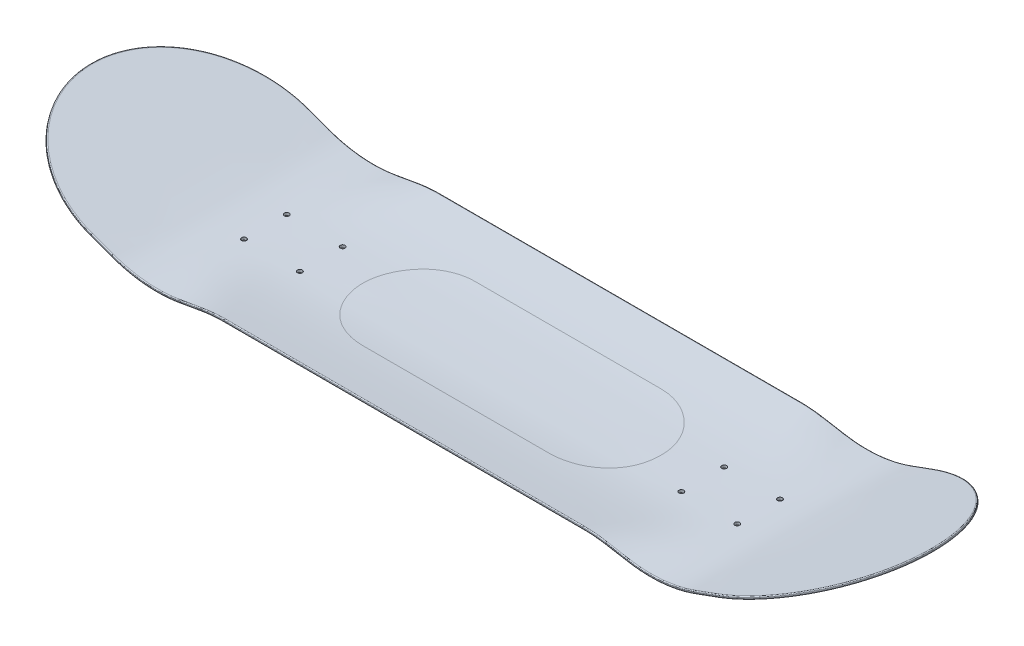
SolidWorks part; units mm, degrees
ref_plane "Front Plane" through (0, 0, 0) normal (0, 0, 1) x (1, 0, 0)
ref_plane "Top Plane" through (0, 0, 0) normal (0, 1, 0) x (1, 0, 0)
ref_plane "Right Plane" through (0, 0, 0) normal (1, 0, 0) x (0, 0, -1)
ref_plane "Plane1" through (0, 0, 104.775) normal (0, 0, 1) x (1, 0, 0)
ref_plane "Plane2" through (0, 0, -104.775) normal (0, 0, 1) x (1, 0, 0)
ref_plane "Plane3" through (0, 0, 25.4) normal (0, 0, 1) x (1, 0, 0)
ref_plane "Plane4" through (0, 0, -25.4) normal (0, 0, 1) x (1, 0, 0)
sketch "Sketch1" plane through (0, 0, 104.775) normal (0, 0, 1) x (1, 0, 0)
  line L0 (-216.0717, -5.6287) -> (-195.0923, -1.9294)
  line L1 (-173.0389, 0) -> (173.0389, 0)
  line L3 (-281.5616, 0.101) -> (-406.4, 45.5384)
  line L4 (281.5616, 0.101) -> (406.4, 45.5384)
  line L5 (195.0923, -1.9294) -> (216.0717, -5.6287)
  line L6 (0, 0) -> (0, -50000) construction
  line L7 (13.6066, -7.5581) -> (-49986.3934, -7.5581) construction
  arc A0 (-281.5616, 0.101) -> (-216.0717, -5.6287) centre (-238.125, 119.4419) ccw
  arc A1 (-195.0923, -1.9294) -> (-173.0389, 0) centre (-173.0389, -127) cw
  arc A2 (173.0389, 0) -> (195.0923, -1.9294) centre (173.0389, -127) cw
  arc A3 (216.0717, -5.6287) -> (281.5616, 0.101) centre (238.125, 119.4419) ccw
  point P4 (0, 0)
  point P13 (-249.5842, -11.5378)
  point P17 (-184.15, 0)
  point P20 (184.15, 0)
  point P23 (-238.125, -7.5581)
sketch "Sketch2" plane through (0, 0, 0) normal (0, 0, 1) x (1, 0, 0)
  line L0 (0, -7.5581) -> (-50000, -7.5581) construction
  line L2 (-238.125, -7.5581) -> (238.125, -7.5581)
  line L12 (-281.5616, 0.101) -> (-406.4, 45.5384) construction
  line L16 (281.5616, 0.101) -> (406.4, 45.5384) construction
  line L19 (-281.5616, 0.101) -> (-406.4, 45.5384)
  line L23 (281.5616, 0.101) -> (406.4, 45.5384)
  arc A0 (-281.5616, 0.101) -> (-216.0717, -5.6287) centre (-238.125, 119.4419) ccw construction
  arc A1 (281.5616, 0.101) -> (238.125, -7.5581) centre (238.125, 119.4419) cw
  arc A2 (-238.125, -7.5581) -> (-281.5616, 0.101) centre (-238.125, 119.4419) cw
  point P11 (260.5185, -7.5581)
  point P14 (-260.5185, -7.5581)
sketch "Sketch3" plane through (0, 0, 0) normal (0, 1, 0) x (1, 0, 0)
  line L0 (-301.625, 0) -> (301.625, 0) construction
  line L1 (-301.625, 104.775) -> (301.625, 104.775)
  line L2 (-301.625, -104.775) -> (301.625, -104.775)
  arc A0 (-301.625, 104.775) -> (-301.625, -104.775) centre (-301.625, 0) ccw
  arc A1 (301.625, -104.775) -> (301.625, 104.775) centre (301.625, 0) ccw
  point P2 (0, 0)
  point P8 (-406.4, 0)
  point P9 (406.4, 0)
sketch "Sketch4" plane through (0, 0, -104.775) normal (0, 0, 1) x (1, 0, 0)
  line L0 (-281.5616, 0.101) -> (-406.4, 45.5384) construction
  line L1 (-216.0717, -5.6287) -> (-195.0923, -1.9294) construction
  line L2 (-173.0389, 0) -> (173.0389, 0) construction
  line L3 (195.0923, -1.9294) -> (216.0717, -5.6287) construction
  line L4 (281.5616, 0.101) -> (406.4, 45.5384) construction
  line L5 (-281.5616, 0.101) -> (-406.4, 45.5384)
  line L6 (-216.0717, -5.6287) -> (-195.0923, -1.9294)
  line L7 (-173.0389, 0) -> (173.0389, 0)
  line L8 (195.0923, -1.9294) -> (216.0717, -5.6287)
  line L9 (281.5616, 0.101) -> (406.4, 45.5384)
  arc A0 (-281.5616, 0.101) -> (-216.0717, -5.6287) centre (-238.125, 119.4419) ccw construction
  arc A1 (-173.0389, 0) -> (-195.0923, -1.9294) centre (-173.0389, -127) ccw construction
  arc A2 (195.0923, -1.9294) -> (173.0389, 0) centre (173.0389, -127) ccw construction
  arc A3 (216.0717, -5.6287) -> (281.5616, 0.101) centre (238.125, 119.4419) ccw construction
  arc A4 (-281.5616, 0.101) -> (-216.0717, -5.6287) centre (-238.125, 119.4419) ccw
  arc A5 (-173.0389, 0) -> (-195.0923, -1.9294) centre (-173.0389, -127) ccw
  arc A6 (195.0923, -1.9294) -> (173.0389, 0) centre (173.0389, -127) ccw
  arc A7 (216.0717, -5.6287) -> (281.5616, 0.101) centre (238.125, 119.4419) ccw
sketch "Sketch5" plane through (0, 0, 25.4) normal (0, 0, 1) x (1, 0, 0)
  line L3 (281.5616, 0.101) -> (406.4, 45.5384) construction
  line L4 (-238.125, -7.5581) -> (238.125, -7.5581) construction
  line L5 (-281.5616, 0.101) -> (-406.4, 45.5384) construction
  line L6 (281.5616, 0.101) -> (406.4, 45.5384)
  line L7 (-238.125, -7.5581) -> (238.125, -7.5581)
  line L8 (-281.5616, 0.101) -> (-406.4, 45.5384)
  arc A2 (238.125, -7.5581) -> (281.5616, 0.101) centre (238.125, 119.4419) ccw construction
  arc A3 (-281.5616, 0.101) -> (-238.125, -7.5581) centre (-238.125, 119.4419) ccw construction
  arc A4 (238.125, -7.5581) -> (281.5616, 0.101) centre (238.125, 119.4419) ccw
  arc A5 (-281.5616, 0.101) -> (-238.125, -7.5581) centre (-238.125, 119.4419) ccw
sketch "Sketch6" plane through (0, 0, -25.4) normal (0, 0, 1) x (1, 0, 0)
  line L3 (281.5616, 0.101) -> (406.4, 45.5384) construction
  line L4 (-238.125, -7.5581) -> (238.125, -7.5581) construction
  line L5 (-281.5616, 0.101) -> (-406.4, 45.5384) construction
  line L6 (281.5616, 0.101) -> (406.4, 45.5384)
  line L7 (-238.125, -7.5581) -> (238.125, -7.5581)
  line L8 (-281.5616, 0.101) -> (-406.4, 45.5384)
  arc A2 (238.125, -7.5581) -> (281.5616, 0.101) centre (238.125, 119.4419) ccw construction
  arc A3 (-281.5616, 0.101) -> (-238.125, -7.5581) centre (-238.125, 119.4419) ccw construction
  arc A4 (238.125, -7.5581) -> (281.5616, 0.101) centre (238.125, 119.4419) ccw
  arc A5 (-281.5616, 0.101) -> (-238.125, -7.5581) centre (-238.125, 119.4419) ccw
other "Boundary-Surface1"
surface "Surface-Trim1"
thicken "Thicken1" surfaces to thicken 110 thickness 1.27 parameters "D1"=1.27
sketch "Sketch8" plane through (0, 0, 0) normal (0, -1, 0) x (-1, 0, 0)
  line L0 (0, -9.525) -> (0, 0) construction
  line L1 (-2.7496, -7.9375) -> (-19.2474, -36.5125)
  line L2 (-16.4978, -41.275) -> (16.4978, -41.275)
  line L3 (19.2474, -36.5125) -> (2.7496, -7.9375)
  line L4 (-8.2489, -4.7625) -> (0, 0) construction
  line L5 (-8.2489, -1.5875) -> (-41.2445, -1.5875)
  line L6 (-43.9941, -6.35) -> (-27.4963, -34.925)
  line L7 (-21.997, -34.925) -> (-5.4993, -6.35)
  line L8 (-8.2489, 4.7625) -> (0, 0) construction
  line L9 (-5.4993, 6.35) -> (-21.997, 34.925)
  line L10 (-27.4963, 34.925) -> (-43.9941, 6.35)
  line L11 (-41.2445, 1.5875) -> (-8.2489, 1.5875)
  line L12 (0, 9.525) -> (0, 0) construction
  line L13 (2.7496, 7.9375) -> (19.2474, 36.5125)
  line L14 (16.4978, 41.275) -> (-16.4978, 41.275)
  line L15 (-19.2474, 36.5125) -> (-2.7496, 7.9375)
  line L16 (8.2489, 4.7625) -> (0, 0) construction
  line L17 (8.2489, 1.5875) -> (41.2445, 1.5875)
  line L18 (43.9941, 6.35) -> (27.4963, 34.925)
  line L19 (21.997, 34.925) -> (5.4993, 6.35)
  line L20 (8.2489, -4.7625) -> (0, 0) construction
  line L21 (5.4993, -6.35) -> (21.997, -34.925)
  line L22 (27.4963, -34.925) -> (43.9941, -6.35)
  line L23 (41.2445, -1.5875) -> (8.2489, -1.5875)
  line L108 (-54.9926, 6.35) -> (-71.4904, 34.925)
  line L193 (-76.9897, 34.925) -> (-93.4874, 6.35)
  line L281 (-90.7378, 1.5875) -> (-57.7422, 1.5875)
  line L282 (-46.7437, 7.9375) -> (-30.2459, 36.5125)
  line L283 (-32.9956, 41.275) -> (-65.9911, 41.275)
  line L284 (-68.7408, 36.5125) -> (-52.243, 7.9375)
  line L285 (-57.7422, -1.5875) -> (-90.7378, -1.5875)
  line L286 (-93.4874, -6.35) -> (-76.9897, -34.925)
  line L287 (-71.4904, -34.925) -> (-54.9926, -6.35)
  line L288 (-52.243, -7.9375) -> (-68.7408, -36.5125)
  line L289 (-65.9911, -41.275) -> (-32.9956, -41.275)
  line L290 (-30.2459, -36.5125) -> (-46.7437, -7.9375)
  line L291 (-104.486, 6.35) -> (-120.9837, 34.925)
  line L292 (-126.483, 34.925) -> (-142.9808, 6.35)
  line L293 (-140.2312, 1.5875) -> (-107.2356, 1.5875)
  line L294 (-96.2371, 7.9375) -> (-79.7393, 36.5125)
  line L295 (-82.4889, 41.275) -> (-115.4845, 41.275)
  line L296 (-118.2341, 36.5125) -> (-101.7363, 7.9375)
  line L297 (-107.2356, -1.5875) -> (-140.2312, -1.5875)
  line L298 (-142.9808, -6.35) -> (-126.483, -34.925)
  line L299 (-120.9837, -34.925) -> (-104.486, -6.35)
  line L300 (-101.7363, -7.9375) -> (-118.2341, -36.5125)
  line L301 (-115.4845, -41.275) -> (-82.4889, -41.275)
  line L302 (-79.7393, -36.5125) -> (-96.2371, -7.9375)
  line L303 (-153.9793, 6.35) -> (-170.4771, 34.925) construction
  line L304 (-175.9764, 34.925) -> (-192.4741, 6.35) construction
  line L305 (-189.7245, 1.5875) -> (-156.7289, 1.5875) construction
  line L306 (-145.7304, 7.9375) -> (-129.2326, 36.5125)
  line L307 (-131.9823, 41.275) -> (-164.9778, 41.275)
  line L308 (-167.7275, 36.5125) -> (-151.2297, 7.9375)
  line L309 (-156.7289, -1.5875) -> (-189.7245, -1.5875) construction
  line L310 (-192.4741, -6.35) -> (-175.9764, -34.925) construction
  line L311 (-170.4771, -34.925) -> (-153.9793, -6.35) construction
  line L312 (-151.2297, -7.9375) -> (-167.7275, -36.5125)
  line L313 (-164.9778, -41.275) -> (-131.9823, -41.275)
  line L314 (-129.2326, -36.5125) -> (-145.7304, -7.9375)
  line L315 (-203.4727, 6.35) -> (-219.9705, 34.925) construction
  line L316 (-225.4697, 34.925) -> (-241.9675, 6.35) construction
  line L317 (-239.2179, 1.5875) -> (-206.2223, 1.5875) construction
  line L318 (-195.2238, 7.9375) -> (-178.726, 36.5125) construction
  line L319 (-181.4756, 41.275) -> (-214.4712, 41.275) construction
  line L320 (-217.2208, 36.5125) -> (-200.723, 7.9375) construction
  line L321 (-206.2223, -1.5875) -> (-239.2179, -1.5875) construction
  line L322 (-241.9675, -6.35) -> (-225.4697, -34.925) construction
  line L323 (-219.9705, -34.925) -> (-203.4727, -6.35) construction
  line L324 (-200.723, -7.9375) -> (-217.2208, -36.5125) construction
  line L325 (-214.4712, -41.275) -> (-181.4756, -41.275) construction
  line L326 (-178.726, -36.5125) -> (-195.2238, -7.9375) construction
  line L327 (-252.966, 6.35) -> (-269.4638, 34.925)
  line L328 (-274.9631, 34.925) -> (-291.4608, 6.35)
  line L329 (-288.7112, 1.5875) -> (-255.7157, 1.5875)
  line L330 (-244.7171, 7.9375) -> (-228.2193, 36.5125) construction
  line L331 (-230.969, 41.275) -> (-263.9645, 41.275) construction
  line L332 (-266.7142, 36.5125) -> (-250.2164, 7.9375) construction
  line L333 (-255.7157, -1.5875) -> (-288.7112, -1.5875)
  line L334 (-291.4608, -6.35) -> (-274.9631, -34.925)
  line L335 (-269.4638, -34.925) -> (-252.966, -6.35)
  line L336 (-250.2164, -7.9375) -> (-266.7142, -36.5125) construction
  line L337 (-263.9645, -41.275) -> (-230.969, -41.275) construction
  line L338 (-228.2193, -36.5125) -> (-244.7171, -7.9375) construction
  line L339 (-302.4594, 6.35) -> (-318.9572, 34.925)
  line L340 (-324.4564, 34.925) -> (-340.9542, 6.35)
  line L341 (-338.2046, 1.5875) -> (-305.209, 1.5875)
  line L342 (-294.2105, 7.9375) -> (-277.7127, 36.5125)
  line L343 (-280.4623, 41.275) -> (-313.4579, 41.275)
  line L344 (-316.2075, 36.5125) -> (-299.7097, 7.9375)
  line L345 (-305.209, -1.5875) -> (-338.2046, -1.5875)
  line L346 (-340.9542, -6.35) -> (-324.4564, -34.925)
  line L347 (-318.9572, -34.925) -> (-302.4594, -6.35)
  line L348 (-299.7097, -7.9375) -> (-316.2075, -36.5125)
  line L349 (-313.4579, -41.275) -> (-280.4623, -41.275)
  line L350 (-277.7127, -36.5125) -> (-294.2105, -7.9375)
  line L351 (-351.9527, 6.35) -> (-368.4505, 34.925)
  line L352 (-373.9498, 34.925) -> (-390.4476, 6.35)
  line L353 (-387.6979, 1.5875) -> (-354.7024, 1.5875)
  line L354 (-343.7038, 7.9375) -> (-327.206, 36.5125)
  line L355 (-329.9557, 41.275) -> (-362.9512, 41.275)
  line L356 (-365.7009, 36.5125) -> (-349.2031, 7.9375)
  line L357 (-354.7024, -1.5875) -> (-387.6979, -1.5875)
  line L358 (-390.4476, -6.35) -> (-373.9498, -34.925)
  line L359 (-368.4505, -34.925) -> (-351.9527, -6.35)
  line L360 (-349.2031, -7.9375) -> (-365.7009, -36.5125)
  line L361 (-362.9512, -41.275) -> (-329.9557, -41.275)
  line L362 (-327.206, -36.5125) -> (-343.7038, -7.9375)
  line L363 (329.9557, 44.45) -> (362.9512, 44.45)
  line L364 (46.7437, -7.9375) -> (30.2459, -36.5125)
  line L365 (32.9956, -41.275) -> (65.9911, -41.275)
  line L366 (68.7408, -36.5125) -> (52.243, -7.9375)
  line L367 (54.9926, -6.35) -> (71.4904, -34.925)
  line L368 (76.9897, -34.925) -> (93.4874, -6.35)
  line L369 (90.7378, -1.5875) -> (57.7422, -1.5875)
  line L370 (57.7422, 1.5875) -> (90.7378, 1.5875)
  line L371 (93.4874, 6.35) -> (76.9897, 34.925)
  line L372 (71.4904, 34.925) -> (54.9926, 6.35)
  line L373 (52.243, 7.9375) -> (68.7408, 36.5125)
  line L374 (65.9911, 41.275) -> (32.9956, 41.275)
  line L375 (30.2459, 36.5125) -> (46.7437, 7.9375)
  line L376 (96.2371, -7.9375) -> (79.7393, -36.5125)
  line L377 (82.4889, -41.275) -> (115.4845, -41.275)
  line L378 (118.2341, -36.5125) -> (101.7363, -7.9375)
  line L379 (104.486, -6.35) -> (120.9837, -34.925)
  line L380 (126.483, -34.925) -> (142.9808, -6.35)
  line L381 (140.2312, -1.5875) -> (107.2356, -1.5875)
  line L382 (107.2356, 1.5875) -> (140.2312, 1.5875)
  line L383 (142.9808, 6.35) -> (126.483, 34.925)
  line L384 (120.9837, 34.925) -> (104.486, 6.35)
  line L385 (101.7363, 7.9375) -> (118.2341, 36.5125)
  line L386 (115.4845, 41.275) -> (82.4889, 41.275)
  line L387 (79.7393, 36.5125) -> (96.2371, 7.9375)
  line L388 (145.7304, -7.9375) -> (129.2326, -36.5125)
  line L389 (131.9823, -41.275) -> (164.9778, -41.275)
  line L390 (167.7275, -36.5125) -> (151.2297, -7.9375)
  line L391 (153.9793, -6.35) -> (170.4771, -34.925) construction
  line L392 (175.9764, -34.925) -> (192.4741, -6.35) construction
  line L393 (189.7245, -1.5875) -> (156.7289, -1.5875) construction
  line L394 (156.7289, 1.5875) -> (189.7245, 1.5875) construction
  line L395 (192.4741, 6.35) -> (175.9764, 34.925) construction
  line L396 (170.4771, 34.925) -> (153.9793, 6.35) construction
  line L397 (151.2297, 7.9375) -> (167.7275, 36.5125)
  line L398 (164.9778, 41.275) -> (131.9823, 41.275)
  line L399 (129.2326, 36.5125) -> (145.7304, 7.9375)
  line L400 (195.2238, -7.9375) -> (178.726, -36.5125) construction
  line L401 (181.4756, -41.275) -> (214.4712, -41.275) construction
  line L402 (217.2208, -36.5125) -> (200.723, -7.9375) construction
  line L403 (203.4727, -6.35) -> (219.9705, -34.925) construction
  line L404 (225.4697, -34.925) -> (241.9675, -6.35) construction
  line L405 (239.2179, -1.5875) -> (206.2223, -1.5875) construction
  line L406 (206.2223, 1.5875) -> (239.2179, 1.5875) construction
  line L407 (241.9675, 6.35) -> (225.4697, 34.925) construction
  line L408 (219.9705, 34.925) -> (203.4727, 6.35) construction
  line L409 (200.723, 7.9375) -> (217.2208, 36.5125) construction
  line L410 (214.4712, 41.275) -> (181.4756, 41.275) construction
  line L411 (178.726, 36.5125) -> (195.2238, 7.9375) construction
  line L412 (244.7171, -7.9375) -> (228.2193, -36.5125) construction
  line L413 (230.969, -41.275) -> (263.9645, -41.275) construction
  line L414 (266.7142, -36.5125) -> (250.2164, -7.9375) construction
  line L415 (252.966, -6.35) -> (269.4638, -34.925)
  line L416 (274.9631, -34.925) -> (291.4608, -6.35)
  line L417 (288.7112, -1.5875) -> (255.7157, -1.5875)
  line L418 (255.7157, 1.5875) -> (288.7112, 1.5875)
  line L419 (291.4608, 6.35) -> (274.9631, 34.925)
  line L420 (269.4638, 34.925) -> (252.966, 6.35)
  line L421 (250.2164, 7.9375) -> (266.7142, 36.5125) construction
  line L422 (263.9645, 41.275) -> (230.969, 41.275) construction
  line L423 (228.2193, 36.5125) -> (244.7171, 7.9375) construction
  line L424 (294.2105, -7.9375) -> (277.7127, -36.5125)
  line L425 (280.4623, -41.275) -> (313.4579, -41.275)
  line L426 (316.2075, -36.5125) -> (299.7097, -7.9375)
  line L427 (302.4594, -6.35) -> (318.9572, -34.925)
  line L428 (324.4564, -34.925) -> (340.9542, -6.35)
  line L429 (338.2046, -1.5875) -> (305.209, -1.5875)
  line L430 (305.209, 1.5875) -> (338.2046, 1.5875)
  line L431 (340.9542, 6.35) -> (324.4564, 34.925)
  line L432 (318.9572, 34.925) -> (302.4594, 6.35)
  line L433 (299.7097, 7.9375) -> (316.2075, 36.5125)
  line L434 (313.4579, 41.275) -> (280.4623, 41.275)
  line L435 (277.7127, 36.5125) -> (294.2105, 7.9375)
  line L436 (343.7038, -7.9375) -> (327.206, -36.5125)
  line L437 (329.9557, -41.275) -> (362.9512, -41.275)
  line L438 (365.7009, -36.5125) -> (349.2031, -7.9375)
  line L439 (351.9527, -6.35) -> (368.4505, -34.925)
  line L440 (373.9498, -34.925) -> (390.4476, -6.35)
  line L441 (387.6979, -1.5875) -> (354.7024, -1.5875)
  line L442 (354.7024, 1.5875) -> (387.6979, 1.5875)
  line L443 (390.4476, 6.35) -> (373.9498, 34.925)
  line L444 (368.4505, 34.925) -> (351.9527, 6.35)
  line L445 (349.2031, 7.9375) -> (365.7009, 36.5125)
  line L446 (362.9512, 41.275) -> (329.9557, 41.275)
  line L447 (327.206, 36.5125) -> (343.7038, 7.9375)
  line L448 (365.7009, 49.2125) -> (349.2031, 77.7875)
  line L449 (343.7038, 77.7875) -> (327.206, 49.2125)
  line L450 (324.4564, 50.8) -> (340.9542, 79.375)
  line L451 (338.2046, 84.1375) -> (305.209, 84.1375)
  line L452 (302.4594, 79.375) -> (318.9572, 50.8)
  line L453 (280.4623, 44.45) -> (313.4579, 44.45)
  line L454 (316.2075, 49.2125) -> (299.7097, 77.7875)
  line L455 (294.2105, 77.7875) -> (277.7127, 49.2125)
  line L456 (274.9631, 50.8) -> (291.4608, 79.375)
  line L457 (288.7112, 84.1375) -> (255.7157, 84.1375)
  line L458 (252.966, 79.375) -> (269.4638, 50.8)
  line L459 (230.969, 44.45) -> (263.9645, 44.45)
  line L460 (266.7142, 49.2125) -> (250.2164, 77.7875)
  line L461 (244.7171, 77.7875) -> (228.2193, 49.2125)
  line L462 (225.4697, 50.8) -> (241.9675, 79.375)
  line L463 (239.2179, 84.1375) -> (206.2223, 84.1375)
  line L464 (203.4727, 79.375) -> (219.9705, 50.8)
  line L465 (181.4756, 44.45) -> (214.4712, 44.45)
  line L466 (217.2208, 49.2125) -> (200.723, 77.7875)
  line L467 (195.2238, 77.7875) -> (178.726, 49.2125)
  line L468 (175.9764, 50.8) -> (192.4741, 79.375)
  line L469 (189.7245, 84.1375) -> (156.7289, 84.1375)
  line L470 (153.9793, 79.375) -> (170.4771, 50.8)
  line L471 (131.9823, 44.45) -> (164.9778, 44.45)
  line L472 (167.7275, 49.2125) -> (151.2297, 77.7875)
  line L473 (145.7304, 77.7875) -> (129.2326, 49.2125)
  line L474 (126.483, 50.8) -> (142.9808, 79.375)
  line L475 (140.2312, 84.1375) -> (107.2356, 84.1375)
  line L476 (104.486, 79.375) -> (120.9837, 50.8)
  line L477 (82.4889, 44.45) -> (115.4845, 44.45)
  line L478 (118.2341, 49.2125) -> (101.7363, 77.7875)
  line L479 (96.2371, 77.7875) -> (79.7393, 49.2125)
  line L480 (76.9897, 50.8) -> (93.4874, 79.375)
  line L481 (90.7378, 84.1375) -> (57.7422, 84.1375)
  line L482 (54.9926, 79.375) -> (71.4904, 50.8)
  line L483 (32.9956, 44.45) -> (65.9911, 44.45)
  line L484 (68.7408, 49.2125) -> (52.243, 77.7875)
  line L485 (46.7437, 77.7875) -> (30.2459, 49.2125)
  line L486 (27.4963, 50.8) -> (43.9941, 79.375)
  line L487 (41.2445, 84.1375) -> (8.2489, 84.1375)
  line L488 (5.4993, 79.375) -> (21.997, 50.8)
  line L489 (19.2474, 49.2125) -> (2.7496, 77.7875)
  line L490 (-2.7496, 77.7875) -> (-19.2474, 49.2125)
  line L491 (-16.4978, 44.45) -> (16.4978, 44.45)
  line L492 (-21.997, 50.8) -> (-5.4993, 79.375)
  line L493 (-8.2489, 84.1375) -> (-41.2445, 84.1375)
  line L494 (-43.9941, 79.375) -> (-27.4963, 50.8)
  line L495 (-30.2459, 49.2125) -> (-46.7437, 77.7875)
  line L496 (-52.243, 77.7875) -> (-68.7408, 49.2125)
  line L497 (-65.9911, 44.45) -> (-32.9956, 44.45)
  line L498 (-71.4904, 50.8) -> (-54.9926, 79.375)
  line L499 (-57.7422, 84.1375) -> (-90.7378, 84.1375)
  line L500 (-93.4874, 79.375) -> (-76.9897, 50.8)
  line L501 (-79.7393, 49.2125) -> (-96.2371, 77.7875)
  line L502 (-101.7363, 77.7875) -> (-118.2341, 49.2125)
  line L503 (-115.4845, 44.45) -> (-82.4889, 44.45)
  line L504 (-120.9837, 50.8) -> (-104.486, 79.375)
  line L505 (-107.2356, 84.1375) -> (-140.2312, 84.1375)
  line L506 (-142.9808, 79.375) -> (-126.483, 50.8)
  line L507 (-129.2326, 49.2125) -> (-145.7304, 77.7875)
  line L508 (-151.2297, 77.7875) -> (-167.7275, 49.2125)
  line L509 (-164.9778, 44.45) -> (-131.9823, 44.45)
  line L510 (-170.4771, 50.8) -> (-153.9793, 79.375)
  line L511 (-156.7289, 84.1375) -> (-189.7245, 84.1375)
  line L512 (-192.4741, 79.375) -> (-175.9764, 50.8)
  line L513 (-178.726, 49.2125) -> (-195.2238, 77.7875)
  line L514 (-200.723, 77.7875) -> (-217.2208, 49.2125)
  line L515 (-214.4712, 44.45) -> (-181.4756, 44.45)
  line L516 (-219.9705, 50.8) -> (-203.4727, 79.375)
  line L517 (-206.2223, 84.1375) -> (-239.2179, 84.1375)
  line L518 (-241.9675, 79.375) -> (-225.4697, 50.8)
  line L519 (-228.2193, 49.2125) -> (-244.7171, 77.7875)
  line L520 (-250.2164, 77.7875) -> (-266.7142, 49.2125)
  line L521 (-263.9645, 44.45) -> (-230.969, 44.45)
  line L522 (-269.4638, 50.8) -> (-252.966, 79.375)
  line L523 (-255.7157, 84.1375) -> (-288.7112, 84.1375)
  line L524 (-291.4608, 79.375) -> (-274.9631, 50.8)
  line L525 (-277.7127, 49.2125) -> (-294.2105, 77.7875)
  line L526 (-299.7097, 77.7875) -> (-316.2075, 49.2125)
  line L527 (-313.4579, 44.45) -> (-280.4623, 44.45)
  line L528 (-318.9572, 50.8) -> (-302.4594, 79.375)
  line L529 (-305.209, 84.1375) -> (-338.2046, 84.1375)
  line L530 (-340.9542, 79.375) -> (-324.4564, 50.8)
  line L531 (-327.206, 49.2125) -> (-343.7038, 77.7875)
  line L532 (-349.2031, 77.7875) -> (-365.7009, 49.2125)
  line L533 (-362.9512, 44.45) -> (-329.9557, 44.45)
  line L534 (277.7127, -49.2125) -> (294.2105, -77.7875)
  line L535 (299.7097, -77.7875) -> (316.2075, -49.2125)
  line L536 (313.4579, -44.45) -> (280.4623, -44.45)
  line L537 (269.4638, -50.8) -> (252.966, -79.375)
  line L538 (255.7157, -84.1375) -> (288.7112, -84.1375)
  line L539 (291.4608, -79.375) -> (274.9631, -50.8)
  line L540 (228.2193, -49.2125) -> (244.7171, -77.7875)
  line L541 (250.2164, -77.7875) -> (266.7142, -49.2125)
  line L542 (263.9645, -44.45) -> (230.969, -44.45)
  line L543 (219.9705, -50.8) -> (203.4727, -79.375)
  line L544 (206.2223, -84.1375) -> (239.2179, -84.1375)
  line L545 (241.9675, -79.375) -> (225.4697, -50.8)
  line L546 (178.726, -49.2125) -> (195.2238, -77.7875)
  line L547 (200.723, -77.7875) -> (217.2208, -49.2125)
  line L548 (214.4712, -44.45) -> (181.4756, -44.45)
  line L549 (170.4771, -50.8) -> (153.9793, -79.375)
  line L550 (156.7289, -84.1375) -> (189.7245, -84.1375)
  line L551 (192.4741, -79.375) -> (175.9764, -50.8)
  line L552 (129.2326, -49.2125) -> (145.7304, -77.7875)
  line L553 (151.2297, -77.7875) -> (167.7275, -49.2125)
  line L554 (164.9778, -44.45) -> (131.9823, -44.45)
  line L555 (120.9837, -50.8) -> (104.486, -79.375)
  line L556 (107.2356, -84.1375) -> (140.2312, -84.1375)
  line L557 (142.9808, -79.375) -> (126.483, -50.8)
  line L558 (79.7393, -49.2125) -> (96.2371, -77.7875)
  line L559 (101.7363, -77.7875) -> (118.2341, -49.2125)
  line L560 (115.4845, -44.45) -> (82.4889, -44.45)
  line L561 (71.4904, -50.8) -> (54.9926, -79.375)
  line L562 (57.7422, -84.1375) -> (90.7378, -84.1375)
  line L563 (93.4874, -79.375) -> (76.9897, -50.8)
  line L564 (30.2459, -49.2125) -> (46.7437, -77.7875)
  line L565 (52.243, -77.7875) -> (68.7408, -49.2125)
  line L566 (65.9911, -44.45) -> (32.9956, -44.45)
  line L567 (21.997, -50.8) -> (5.4993, -79.375)
  line L568 (8.2489, -84.1375) -> (41.2445, -84.1375)
  line L569 (43.9941, -79.375) -> (27.4963, -50.8)
  line L570 (-19.2474, -49.2125) -> (-2.7496, -77.7875)
  line L571 (2.7496, -77.7875) -> (19.2474, -49.2125)
  line L572 (16.4978, -44.45) -> (-16.4978, -44.45)
  line L573 (-27.4963, -50.8) -> (-43.9941, -79.375)
  line L574 (-41.2445, -84.1375) -> (-8.2489, -84.1375)
  line L575 (-5.4993, -79.375) -> (-21.997, -50.8)
  line L576 (-32.9956, -44.45) -> (-65.9911, -44.45)
  line L577 (-68.7408, -49.2125) -> (-52.243, -77.7875)
  line L578 (-46.7437, -77.7875) -> (-30.2459, -49.2125)
  line L579 (-76.9897, -50.8) -> (-93.4874, -79.375)
  line L580 (-90.7378, -84.1375) -> (-57.7422, -84.1375)
  line L581 (-54.9926, -79.375) -> (-71.4904, -50.8)
  line L582 (-82.4889, -44.45) -> (-115.4845, -44.45)
  line L583 (-118.2341, -49.2125) -> (-101.7363, -77.7875)
  line L584 (-96.2371, -77.7875) -> (-79.7393, -49.2125)
  line L585 (-126.483, -50.8) -> (-142.9808, -79.375)
  line L586 (-140.2312, -84.1375) -> (-107.2356, -84.1375)
  line L587 (-104.486, -79.375) -> (-120.9837, -50.8)
  line L588 (-131.9823, -44.45) -> (-164.9778, -44.45)
  line L589 (-167.7275, -49.2125) -> (-151.2297, -77.7875)
  line L590 (-145.7304, -77.7875) -> (-129.2326, -49.2125)
  line L591 (-175.9764, -50.8) -> (-192.4741, -79.375)
  line L592 (-189.7245, -84.1375) -> (-156.7289, -84.1375)
  line L593 (-153.9793, -79.375) -> (-170.4771, -50.8)
  line L594 (-181.4756, -44.45) -> (-214.4712, -44.45)
  line L595 (-217.2208, -49.2125) -> (-200.723, -77.7875)
  line L596 (-195.2238, -77.7875) -> (-178.726, -49.2125)
  line L597 (-225.4697, -50.8) -> (-241.9675, -79.375)
  line L598 (-239.2179, -84.1375) -> (-206.2223, -84.1375)
  line L599 (-203.4727, -79.375) -> (-219.9705, -50.8)
  line L600 (-230.969, -44.45) -> (-263.9645, -44.45)
  line L601 (-266.7142, -49.2125) -> (-250.2164, -77.7875)
  line L602 (-244.7171, -77.7875) -> (-228.2193, -49.2125)
  line L603 (-274.9631, -50.8) -> (-291.4608, -79.375)
  line L604 (-288.7112, -84.1375) -> (-255.7157, -84.1375)
  line L605 (-252.966, -79.375) -> (-269.4638, -50.8)
  line L606 (-280.4623, -44.45) -> (-313.4579, -44.45)
  line L607 (-316.2075, -49.2125) -> (-299.7097, -77.7875)
  line L608 (-294.2105, -77.7875) -> (-277.7127, -49.2125)
  line L609 (-324.4564, -50.8) -> (-340.9542, -79.375)
  line L610 (-338.2046, -84.1375) -> (-305.209, -84.1375)
  line L611 (-302.4594, -79.375) -> (-318.9572, -50.8)
  line L612 (-329.9557, -44.45) -> (-362.9512, -44.45)
  line L613 (-365.7009, -49.2125) -> (-349.2031, -77.7875)
  line L614 (-343.7038, -77.7875) -> (-327.206, -49.2125)
  line L615 (318.9572, -50.8) -> (302.4594, -79.375)
  line L616 (305.209, -84.1375) -> (338.2046, -84.1375)
  line L617 (340.9542, -79.375) -> (324.4564, -50.8)
  line L618 (327.206, -49.2125) -> (343.7038, -77.7875)
  line L619 (349.2031, -77.7875) -> (365.7009, -49.2125)
  line L620 (362.9512, -44.45) -> (329.9557, -44.45)
  circle A1 centre (0, -28.575) radius 12.7 construction
  arc A2 (2.7496, -7.9375) -> (-2.7496, -7.9375) centre (0, -9.525) ccw
  arc A3 (-19.2474, -36.5125) -> (-16.4978, -41.275) centre (-16.4978, -38.1) ccw
  arc A4 (16.4978, -41.275) -> (19.2474, -36.5125) centre (16.4978, -38.1) ccw
  arc A5 (-41.2445, -1.5875) -> (-43.9941, -6.35) centre (-41.2445, -4.7625) ccw
  arc A6 (-5.4993, -6.35) -> (-8.2489, -1.5875) centre (-8.2489, -4.7625) ccw
  arc A7 (-27.4963, -34.925) -> (-21.997, -34.925) centre (-24.7467, -33.3375) ccw
  arc A8 (-21.997, 34.925) -> (-27.4963, 34.925) centre (-24.7467, 33.3375) ccw
  arc A9 (-8.2489, 1.5875) -> (-5.4993, 6.35) centre (-8.2489, 4.7625) ccw
  arc A10 (-43.9941, 6.35) -> (-41.2445, 1.5875) centre (-41.2445, 4.7625) ccw
  arc A11 (19.2474, 36.5125) -> (16.4978, 41.275) centre (16.4978, 38.1) ccw
  arc A12 (-2.7496, 7.9375) -> (2.7496, 7.9375) centre (0, 9.525) ccw
  arc A13 (-16.4978, 41.275) -> (-19.2474, 36.5125) centre (-16.4978, 38.1) ccw
  arc A14 (41.2445, 1.5875) -> (43.9941, 6.35) centre (41.2445, 4.7625) ccw
  arc A15 (5.4993, 6.35) -> (8.2489, 1.5875) centre (8.2489, 4.7625) ccw
  arc A16 (27.4963, 34.925) -> (21.997, 34.925) centre (24.7467, 33.3375) ccw
  arc A17 (21.997, -34.925) -> (27.4963, -34.925) centre (24.7467, -33.3375) ccw
  arc A18 (8.2489, -1.5875) -> (5.4993, -6.35) centre (8.2489, -4.7625) ccw
  arc A19 (43.9941, -6.35) -> (41.2445, -1.5875) centre (41.2445, -4.7625) ccw
  arc A275 (-71.4904, 34.925) -> (-76.9897, 34.925) centre (-74.24, 33.3375) ccw
  arc A276 (-93.4874, 6.35) -> (-90.7378, 1.5875) centre (-90.7378, 4.7625) ccw
  arc A277 (-57.7422, 1.5875) -> (-54.9926, 6.35) centre (-57.7422, 4.7625) ccw
  arc A278 (-30.2459, 36.5125) -> (-32.9956, 41.275) centre (-32.9956, 38.1) ccw
  arc A279 (-65.9911, 41.275) -> (-68.7408, 36.5125) centre (-65.9911, 38.1) ccw
  arc A280 (-52.243, 7.9375) -> (-46.7437, 7.9375) centre (-49.4934, 9.525) ccw
  arc A281 (-90.7378, -1.5875) -> (-93.4874, -6.35) centre (-90.7378, -4.7625) ccw
  arc A282 (-76.9897, -34.925) -> (-71.4904, -34.925) centre (-74.24, -33.3375) ccw
  arc A283 (-54.9926, -6.35) -> (-57.7422, -1.5875) centre (-57.7422, -4.7625) ccw
  arc A284 (-68.7408, -36.5125) -> (-65.9911, -41.275) centre (-65.9911, -38.1) ccw
  arc A285 (-46.7437, -7.9375) -> (-52.243, -7.9375) centre (-49.4934, -9.525) ccw
  arc A286 (-32.9956, -41.275) -> (-30.2459, -36.5125) centre (-32.9956, -38.1) ccw
  arc A287 (-120.9837, 34.925) -> (-126.483, 34.925) centre (-123.7334, 33.3375) ccw
  arc A288 (-142.9808, 6.35) -> (-140.2312, 1.5875) centre (-140.2312, 4.7625) ccw
  arc A289 (-107.2356, 1.5875) -> (-104.486, 6.35) centre (-107.2356, 4.7625) ccw
  arc A290 (-79.7393, 36.5125) -> (-82.4889, 41.275) centre (-82.4889, 38.1) ccw
  arc A291 (-115.4845, 41.275) -> (-118.2341, 36.5125) centre (-115.4845, 38.1) ccw
  arc A292 (-101.7363, 7.9375) -> (-96.2371, 7.9375) centre (-98.9867, 9.525) ccw
  arc A293 (-140.2312, -1.5875) -> (-142.9808, -6.35) centre (-140.2312, -4.7625) ccw
  arc A294 (-126.483, -34.925) -> (-120.9837, -34.925) centre (-123.7334, -33.3375) ccw
  arc A295 (-104.486, -6.35) -> (-107.2356, -1.5875) centre (-107.2356, -4.7625) ccw
  arc A296 (-118.2341, -36.5125) -> (-115.4845, -41.275) centre (-115.4845, -38.1) ccw
  arc A297 (-96.2371, -7.9375) -> (-101.7363, -7.9375) centre (-98.9867, -9.525) ccw
  arc A298 (-82.4889, -41.275) -> (-79.7393, -36.5125) centre (-82.4889, -38.1) ccw
  arc A299 (-170.4771, 34.925) -> (-175.9764, 34.925) centre (-173.2267, 33.3375) ccw construction
  arc A300 (-192.4741, 6.35) -> (-189.7245, 1.5875) centre (-189.7245, 4.7625) ccw construction
  arc A301 (-156.7289, 1.5875) -> (-153.9793, 6.35) centre (-156.7289, 4.7625) ccw construction
  arc A302 (-129.2326, 36.5125) -> (-131.9823, 41.275) centre (-131.9823, 38.1) ccw
  arc A303 (-164.9778, 41.275) -> (-167.7275, 36.5125) centre (-164.9778, 38.1) ccw
  arc A304 (-151.2297, 7.9375) -> (-145.7304, 7.9375) centre (-148.4801, 9.525) ccw
  arc A305 (-189.7245, -1.5875) -> (-192.4741, -6.35) centre (-189.7245, -4.7625) ccw construction
  arc A306 (-175.9764, -34.925) -> (-170.4771, -34.925) centre (-173.2267, -33.3375) ccw construction
  arc A307 (-153.9793, -6.35) -> (-156.7289, -1.5875) centre (-156.7289, -4.7625) ccw construction
  arc A308 (-167.7275, -36.5125) -> (-164.9778, -41.275) centre (-164.9778, -38.1) ccw
  arc A309 (-145.7304, -7.9375) -> (-151.2297, -7.9375) centre (-148.4801, -9.525) ccw
  arc A310 (-131.9823, -41.275) -> (-129.2326, -36.5125) centre (-131.9823, -38.1) ccw
  arc A311 (-219.9705, 34.925) -> (-225.4697, 34.925) centre (-222.7201, 33.3375) ccw construction
  arc A312 (-241.9675, 6.35) -> (-239.2179, 1.5875) centre (-239.2179, 4.7625) ccw construction
  arc A313 (-206.2223, 1.5875) -> (-203.4727, 6.35) centre (-206.2223, 4.7625) ccw construction
  arc A314 (-178.726, 36.5125) -> (-181.4756, 41.275) centre (-181.4756, 38.1) ccw construction
  arc A315 (-214.4712, 41.275) -> (-217.2208, 36.5125) centre (-214.4712, 38.1) ccw construction
  arc A316 (-200.723, 7.9375) -> (-195.2238, 7.9375) centre (-197.9734, 9.525) ccw construction
  arc A317 (-239.2179, -1.5875) -> (-241.9675, -6.35) centre (-239.2179, -4.7625) ccw construction
  arc A318 (-225.4697, -34.925) -> (-219.9705, -34.925) centre (-222.7201, -33.3375) ccw construction
  arc A319 (-203.4727, -6.35) -> (-206.2223, -1.5875) centre (-206.2223, -4.7625) ccw construction
  arc A320 (-217.2208, -36.5125) -> (-214.4712, -41.275) centre (-214.4712, -38.1) ccw construction
  arc A321 (-195.2238, -7.9375) -> (-200.723, -7.9375) centre (-197.9734, -9.525) ccw construction
  arc A322 (-181.4756, -41.275) -> (-178.726, -36.5125) centre (-181.4756, -38.1) ccw construction
  arc A323 (-269.4638, 34.925) -> (-274.9631, 34.925) centre (-272.2134, 33.3375) ccw
  arc A324 (-291.4608, 6.35) -> (-288.7112, 1.5875) centre (-288.7112, 4.7625) ccw
  arc A325 (-255.7157, 1.5875) -> (-252.966, 6.35) centre (-255.7157, 4.7625) ccw
  arc A326 (-228.2193, 36.5125) -> (-230.969, 41.275) centre (-230.969, 38.1) ccw construction
  arc A327 (-263.9645, 41.275) -> (-266.7142, 36.5125) centre (-263.9645, 38.1) ccw construction
  arc A328 (-250.2164, 7.9375) -> (-244.7171, 7.9375) centre (-247.4668, 9.525) ccw construction
  arc A329 (-288.7112, -1.5875) -> (-291.4608, -6.35) centre (-288.7112, -4.7625) ccw
  arc A330 (-274.9631, -34.925) -> (-269.4638, -34.925) centre (-272.2134, -33.3375) ccw
  arc A331 (-252.966, -6.35) -> (-255.7157, -1.5875) centre (-255.7157, -4.7625) ccw
  arc A332 (-266.7142, -36.5125) -> (-263.9645, -41.275) centre (-263.9645, -38.1) ccw construction
  arc A333 (-244.7171, -7.9375) -> (-250.2164, -7.9375) centre (-247.4668, -9.525) ccw construction
  arc A334 (-230.969, -41.275) -> (-228.2193, -36.5125) centre (-230.969, -38.1) ccw construction
  arc A335 (-318.9572, 34.925) -> (-324.4564, 34.925) centre (-321.7068, 33.3375) ccw
  arc A336 (-340.9542, 6.35) -> (-338.2046, 1.5875) centre (-338.2046, 4.7625) ccw
  arc A337 (-305.209, 1.5875) -> (-302.4594, 6.35) centre (-305.209, 4.7625) ccw
  arc A338 (-277.7127, 36.5125) -> (-280.4623, 41.275) centre (-280.4623, 38.1) ccw
  arc A339 (-313.4579, 41.275) -> (-316.2075, 36.5125) centre (-313.4579, 38.1) ccw
  arc A340 (-299.7097, 7.9375) -> (-294.2105, 7.9375) centre (-296.9601, 9.525) ccw
  arc A341 (-338.2046, -1.5875) -> (-340.9542, -6.35) centre (-338.2046, -4.7625) ccw
  arc A342 (-324.4564, -34.925) -> (-318.9572, -34.925) centre (-321.7068, -33.3375) ccw
  arc A343 (-302.4594, -6.35) -> (-305.209, -1.5875) centre (-305.209, -4.7625) ccw
  arc A344 (-316.2075, -36.5125) -> (-313.4579, -41.275) centre (-313.4579, -38.1) ccw
  arc A345 (-294.2105, -7.9375) -> (-299.7097, -7.9375) centre (-296.9601, -9.525) ccw
  arc A346 (-280.4623, -41.275) -> (-277.7127, -36.5125) centre (-280.4623, -38.1) ccw
  arc A347 (-368.4505, 34.925) -> (-373.9498, 34.925) centre (-371.2001, 33.3375) ccw
  arc A348 (-390.4476, 6.35) -> (-387.6979, 1.5875) centre (-387.6979, 4.7625) ccw
  arc A349 (-354.7024, 1.5875) -> (-351.9527, 6.35) centre (-354.7024, 4.7625) ccw
  arc A350 (-327.206, 36.5125) -> (-329.9557, 41.275) centre (-329.9557, 38.1) ccw
  arc A351 (-362.9512, 41.275) -> (-365.7009, 36.5125) centre (-362.9512, 38.1) ccw
  arc A352 (-349.2031, 7.9375) -> (-343.7038, 7.9375) centre (-346.4535, 9.525) ccw
  arc A353 (-387.6979, -1.5875) -> (-390.4476, -6.35) centre (-387.6979, -4.7625) ccw
  arc A354 (-373.9498, -34.925) -> (-368.4505, -34.925) centre (-371.2001, -33.3375) ccw
  arc A355 (-351.9527, -6.35) -> (-354.7024, -1.5875) centre (-354.7024, -4.7625) ccw
  arc A356 (-365.7009, -36.5125) -> (-362.9512, -41.275) centre (-362.9512, -38.1) ccw
  arc A357 (-343.7038, -7.9375) -> (-349.2031, -7.9375) centre (-346.4535, -9.525) ccw
  arc A358 (-329.9557, -41.275) -> (-327.206, -36.5125) centre (-329.9557, -38.1) ccw
  arc A359 (30.2459, -36.5125) -> (32.9956, -41.275) centre (32.9956, -38.1) ccw
  arc A360 (52.243, -7.9375) -> (46.7437, -7.9375) centre (49.4934, -9.525) ccw
  arc A361 (65.9911, -41.275) -> (68.7408, -36.5125) centre (65.9911, -38.1) ccw
  arc A362 (71.4904, -34.925) -> (76.9897, -34.925) centre (74.24, -33.3375) ccw
  arc A363 (93.4874, -6.35) -> (90.7378, -1.5875) centre (90.7378, -4.7625) ccw
  arc A364 (57.7422, -1.5875) -> (54.9926, -6.35) centre (57.7422, -4.7625) ccw
  arc A365 (90.7378, 1.5875) -> (93.4874, 6.35) centre (90.7378, 4.7625) ccw
  arc A366 (76.9897, 34.925) -> (71.4904, 34.925) centre (74.24, 33.3375) ccw
  arc A367 (54.9926, 6.35) -> (57.7422, 1.5875) centre (57.7422, 4.7625) ccw
  arc A368 (68.7408, 36.5125) -> (65.9911, 41.275) centre (65.9911, 38.1) ccw
  arc A369 (32.9956, 41.275) -> (30.2459, 36.5125) centre (32.9956, 38.1) ccw
  arc A370 (46.7437, 7.9375) -> (52.243, 7.9375) centre (49.4934, 9.525) ccw
  arc A371 (79.7393, -36.5125) -> (82.4889, -41.275) centre (82.4889, -38.1) ccw
  arc A372 (101.7363, -7.9375) -> (96.2371, -7.9375) centre (98.9867, -9.525) ccw
  arc A373 (115.4845, -41.275) -> (118.2341, -36.5125) centre (115.4845, -38.1) ccw
  arc A374 (120.9837, -34.925) -> (126.483, -34.925) centre (123.7334, -33.3375) ccw
  arc A375 (142.9808, -6.35) -> (140.2312, -1.5875) centre (140.2312, -4.7625) ccw
  arc A376 (107.2356, -1.5875) -> (104.486, -6.35) centre (107.2356, -4.7625) ccw
  arc A377 (140.2312, 1.5875) -> (142.9808, 6.35) centre (140.2312, 4.7625) ccw
  arc A378 (126.483, 34.925) -> (120.9837, 34.925) centre (123.7334, 33.3375) ccw
  arc A379 (104.486, 6.35) -> (107.2356, 1.5875) centre (107.2356, 4.7625) ccw
  arc A380 (118.2341, 36.5125) -> (115.4845, 41.275) centre (115.4845, 38.1) ccw
  arc A381 (82.4889, 41.275) -> (79.7393, 36.5125) centre (82.4889, 38.1) ccw
  arc A382 (96.2371, 7.9375) -> (101.7363, 7.9375) centre (98.9867, 9.525) ccw
  arc A383 (129.2326, -36.5125) -> (131.9823, -41.275) centre (131.9823, -38.1) ccw
  arc A384 (151.2297, -7.9375) -> (145.7304, -7.9375) centre (148.4801, -9.525) ccw
  arc A385 (164.9778, -41.275) -> (167.7275, -36.5125) centre (164.9778, -38.1) ccw
  arc A386 (170.4771, -34.925) -> (175.9764, -34.925) centre (173.2267, -33.3375) ccw construction
  arc A387 (192.4741, -6.35) -> (189.7245, -1.5875) centre (189.7245, -4.7625) ccw construction
  arc A388 (156.7289, -1.5875) -> (153.9793, -6.35) centre (156.7289, -4.7625) ccw construction
  arc A389 (189.7245, 1.5875) -> (192.4741, 6.35) centre (189.7245, 4.7625) ccw construction
  arc A390 (175.9764, 34.925) -> (170.4771, 34.925) centre (173.2267, 33.3375) ccw construction
  arc A391 (153.9793, 6.35) -> (156.7289, 1.5875) centre (156.7289, 4.7625) ccw construction
  arc A392 (167.7275, 36.5125) -> (164.9778, 41.275) centre (164.9778, 38.1) ccw
  arc A393 (131.9823, 41.275) -> (129.2326, 36.5125) centre (131.9823, 38.1) ccw
  arc A394 (145.7304, 7.9375) -> (151.2297, 7.9375) centre (148.4801, 9.525) ccw
  arc A395 (178.726, -36.5125) -> (181.4756, -41.275) centre (181.4756, -38.1) ccw construction
  arc A396 (200.723, -7.9375) -> (195.2238, -7.9375) centre (197.9734, -9.525) ccw construction
  arc A397 (214.4712, -41.275) -> (217.2208, -36.5125) centre (214.4712, -38.1) ccw construction
  arc A398 (219.9705, -34.925) -> (225.4697, -34.925) centre (222.7201, -33.3375) ccw construction
  arc A399 (241.9675, -6.35) -> (239.2179, -1.5875) centre (239.2179, -4.7625) ccw construction
  arc A400 (206.2223, -1.5875) -> (203.4727, -6.35) centre (206.2223, -4.7625) ccw construction
  arc A401 (239.2179, 1.5875) -> (241.9675, 6.35) centre (239.2179, 4.7625) ccw construction
  arc A402 (225.4697, 34.925) -> (219.9705, 34.925) centre (222.7201, 33.3375) ccw construction
  arc A403 (203.4727, 6.35) -> (206.2223, 1.5875) centre (206.2223, 4.7625) ccw construction
  arc A404 (217.2208, 36.5125) -> (214.4712, 41.275) centre (214.4712, 38.1) ccw construction
  arc A405 (181.4756, 41.275) -> (178.726, 36.5125) centre (181.4756, 38.1) ccw construction
  arc A406 (195.2238, 7.9375) -> (200.723, 7.9375) centre (197.9734, 9.525) ccw construction
  arc A407 (228.2193, -36.5125) -> (230.969, -41.275) centre (230.969, -38.1) ccw construction
  arc A408 (250.2164, -7.9375) -> (244.7171, -7.9375) centre (247.4668, -9.525) ccw construction
  arc A409 (263.9645, -41.275) -> (266.7142, -36.5125) centre (263.9645, -38.1) ccw construction
  arc A410 (269.4638, -34.925) -> (274.9631, -34.925) centre (272.2134, -33.3375) ccw
  arc A411 (291.4608, -6.35) -> (288.7112, -1.5875) centre (288.7112, -4.7625) ccw
  arc A412 (255.7157, -1.5875) -> (252.966, -6.35) centre (255.7157, -4.7625) ccw
  arc A413 (288.7112, 1.5875) -> (291.4608, 6.35) centre (288.7112, 4.7625) ccw
  arc A414 (274.9631, 34.925) -> (269.4638, 34.925) centre (272.2134, 33.3375) ccw
  arc A415 (252.966, 6.35) -> (255.7157, 1.5875) centre (255.7157, 4.7625) ccw
  arc A416 (266.7142, 36.5125) -> (263.9645, 41.275) centre (263.9645, 38.1) ccw construction
  arc A417 (230.969, 41.275) -> (228.2193, 36.5125) centre (230.969, 38.1) ccw construction
  arc A418 (244.7171, 7.9375) -> (250.2164, 7.9375) centre (247.4668, 9.525) ccw construction
  arc A419 (277.7127, -36.5125) -> (280.4623, -41.275) centre (280.4623, -38.1) ccw
  arc A420 (299.7097, -7.9375) -> (294.2105, -7.9375) centre (296.9601, -9.525) ccw
  arc A421 (313.4579, -41.275) -> (316.2075, -36.5125) centre (313.4579, -38.1) ccw
  arc A422 (318.9572, -34.925) -> (324.4564, -34.925) centre (321.7068, -33.3375) ccw
  arc A423 (340.9542, -6.35) -> (338.2046, -1.5875) centre (338.2046, -4.7625) ccw
  arc A424 (305.209, -1.5875) -> (302.4594, -6.35) centre (305.209, -4.7625) ccw
  arc A425 (338.2046, 1.5875) -> (340.9542, 6.35) centre (338.2046, 4.7625) ccw
  arc A426 (324.4564, 34.925) -> (318.9572, 34.925) centre (321.7068, 33.3375) ccw
  arc A427 (302.4594, 6.35) -> (305.209, 1.5875) centre (305.209, 4.7625) ccw
  arc A428 (316.2075, 36.5125) -> (313.4579, 41.275) centre (313.4579, 38.1) ccw
  arc A429 (280.4623, 41.275) -> (277.7127, 36.5125) centre (280.4623, 38.1) ccw
  arc A430 (294.2105, 7.9375) -> (299.7097, 7.9375) centre (296.9601, 9.525) ccw
  arc A431 (327.206, -36.5125) -> (329.9557, -41.275) centre (329.9557, -38.1) ccw
  arc A432 (349.2031, -7.9375) -> (343.7038, -7.9375) centre (346.4535, -9.525) ccw
  arc A433 (362.9512, -41.275) -> (365.7009, -36.5125) centre (362.9512, -38.1) ccw
  arc A434 (368.4505, -34.925) -> (373.9498, -34.925) centre (371.2001, -33.3375) ccw
  arc A435 (390.4476, -6.35) -> (387.6979, -1.5875) centre (387.6979, -4.7625) ccw
  arc A436 (354.7024, -1.5875) -> (351.9527, -6.35) centre (354.7024, -4.7625) ccw
  arc A437 (387.6979, 1.5875) -> (390.4476, 6.35) centre (387.6979, 4.7625) ccw
  arc A438 (373.9498, 34.925) -> (368.4505, 34.925) centre (371.2001, 33.3375) ccw
  arc A439 (351.9527, 6.35) -> (354.7024, 1.5875) centre (354.7024, 4.7625) ccw
  arc A440 (365.7009, 36.5125) -> (362.9512, 41.275) centre (362.9512, 38.1) ccw
  arc A441 (329.9557, 41.275) -> (327.206, 36.5125) centre (329.9557, 38.1) ccw
  arc A442 (343.7038, 7.9375) -> (349.2031, 7.9375) centre (346.4535, 9.525) ccw
  arc A443 (362.9512, 44.45) -> (365.7009, 49.2125) centre (362.9512, 47.625) ccw
  arc A444 (349.2031, 77.7875) -> (343.7038, 77.7875) centre (346.4535, 76.2) ccw
  arc A445 (327.206, 49.2125) -> (329.9557, 44.45) centre (329.9557, 47.625) ccw
  arc A446 (340.9542, 79.375) -> (338.2046, 84.1375) centre (338.2046, 80.9625) ccw
  arc A447 (305.209, 84.1375) -> (302.4594, 79.375) centre (305.209, 80.9625) ccw
  arc A448 (318.9572, 50.8) -> (324.4564, 50.8) centre (321.7068, 52.3875) ccw
  arc A449 (313.4579, 44.45) -> (316.2075, 49.2125) centre (313.4579, 47.625) ccw
  arc A450 (299.7097, 77.7875) -> (294.2105, 77.7875) centre (296.9601, 76.2) ccw
  arc A451 (277.7127, 49.2125) -> (280.4623, 44.45) centre (280.4623, 47.625) ccw
  arc A452 (291.4608, 79.375) -> (288.7112, 84.1375) centre (288.7112, 80.9625) ccw
  arc A453 (255.7157, 84.1375) -> (252.966, 79.375) centre (255.7157, 80.9625) ccw
  arc A454 (269.4638, 50.8) -> (274.9631, 50.8) centre (272.2134, 52.3875) ccw
  arc A455 (263.9645, 44.45) -> (266.7142, 49.2125) centre (263.9645, 47.625) ccw
  arc A456 (250.2164, 77.7875) -> (244.7171, 77.7875) centre (247.4668, 76.2) ccw
  arc A457 (228.2193, 49.2125) -> (230.969, 44.45) centre (230.969, 47.625) ccw
  arc A458 (241.9675, 79.375) -> (239.2179, 84.1375) centre (239.2179, 80.9625) ccw
  arc A459 (206.2223, 84.1375) -> (203.4727, 79.375) centre (206.2223, 80.9625) ccw
  arc A460 (219.9705, 50.8) -> (225.4697, 50.8) centre (222.7201, 52.3875) ccw
  arc A461 (214.4712, 44.45) -> (217.2208, 49.2125) centre (214.4712, 47.625) ccw
  arc A462 (200.723, 77.7875) -> (195.2238, 77.7875) centre (197.9734, 76.2) ccw
  arc A463 (178.726, 49.2125) -> (181.4756, 44.45) centre (181.4756, 47.625) ccw
  arc A464 (192.4741, 79.375) -> (189.7245, 84.1375) centre (189.7245, 80.9625) ccw
  arc A465 (156.7289, 84.1375) -> (153.9793, 79.375) centre (156.7289, 80.9625) ccw
  arc A466 (170.4771, 50.8) -> (175.9764, 50.8) centre (173.2267, 52.3875) ccw
  arc A467 (164.9778, 44.45) -> (167.7275, 49.2125) centre (164.9778, 47.625) ccw
  arc A468 (151.2297, 77.7875) -> (145.7304, 77.7875) centre (148.4801, 76.2) ccw
  arc A469 (129.2326, 49.2125) -> (131.9823, 44.45) centre (131.9823, 47.625) ccw
  arc A470 (142.9808, 79.375) -> (140.2312, 84.1375) centre (140.2312, 80.9625) ccw
  arc A471 (107.2356, 84.1375) -> (104.486, 79.375) centre (107.2356, 80.9625) ccw
  arc A472 (120.9837, 50.8) -> (126.483, 50.8) centre (123.7334, 52.3875) ccw
  arc A473 (115.4845, 44.45) -> (118.2341, 49.2125) centre (115.4845, 47.625) ccw
  arc A474 (101.7363, 77.7875) -> (96.2371, 77.7875) centre (98.9867, 76.2) ccw
  arc A475 (79.7393, 49.2125) -> (82.4889, 44.45) centre (82.4889, 47.625) ccw
  arc A476 (93.4874, 79.375) -> (90.7378, 84.1375) centre (90.7378, 80.9625) ccw
  arc A477 (57.7422, 84.1375) -> (54.9926, 79.375) centre (57.7422, 80.9625) ccw
  arc A478 (71.4904, 50.8) -> (76.9897, 50.8) centre (74.24, 52.3875) ccw
  arc A479 (65.9911, 44.45) -> (68.7408, 49.2125) centre (65.9911, 47.625) ccw
  arc A480 (52.243, 77.7875) -> (46.7437, 77.7875) centre (49.4934, 76.2) ccw
  arc A481 (30.2459, 49.2125) -> (32.9956, 44.45) centre (32.9956, 47.625) ccw
  arc A482 (43.9941, 79.375) -> (41.2445, 84.1375) centre (41.2445, 80.9625) ccw
  arc A483 (8.2489, 84.1375) -> (5.4993, 79.375) centre (8.2489, 80.9625) ccw
  arc A484 (21.997, 50.8) -> (27.4963, 50.8) centre (24.7467, 52.3875) ccw
  arc A485 (2.7496, 77.7875) -> (-2.7496, 77.7875) centre (0, 76.2) ccw
  arc A486 (-19.2474, 49.2125) -> (-16.4978, 44.45) centre (-16.4978, 47.625) ccw
  arc A487 (16.4978, 44.45) -> (19.2474, 49.2125) centre (16.4978, 47.625) ccw
  arc A488 (-5.4993, 79.375) -> (-8.2489, 84.1375) centre (-8.2489, 80.9625) ccw
  arc A489 (-41.2445, 84.1375) -> (-43.9941, 79.375) centre (-41.2445, 80.9625) ccw
  arc A490 (-27.4963, 50.8) -> (-21.997, 50.8) centre (-24.7467, 52.3875) ccw
  arc A491 (-46.7437, 77.7875) -> (-52.243, 77.7875) centre (-49.4934, 76.2) ccw
  arc A492 (-68.7408, 49.2125) -> (-65.9911, 44.45) centre (-65.9911, 47.625) ccw
  arc A493 (-32.9956, 44.45) -> (-30.2459, 49.2125) centre (-32.9956, 47.625) ccw
  arc A494 (-54.9926, 79.375) -> (-57.7422, 84.1375) centre (-57.7422, 80.9625) ccw
  arc A495 (-90.7378, 84.1375) -> (-93.4874, 79.375) centre (-90.7378, 80.9625) ccw
  arc A496 (-76.9897, 50.8) -> (-71.4904, 50.8) centre (-74.24, 52.3875) ccw
  arc A497 (-96.2371, 77.7875) -> (-101.7363, 77.7875) centre (-98.9867, 76.2) ccw
  arc A498 (-118.2341, 49.2125) -> (-115.4845, 44.45) centre (-115.4845, 47.625) ccw
  arc A499 (-82.4889, 44.45) -> (-79.7393, 49.2125) centre (-82.4889, 47.625) ccw
  arc A500 (-104.486, 79.375) -> (-107.2356, 84.1375) centre (-107.2356, 80.9625) ccw
  arc A501 (-140.2312, 84.1375) -> (-142.9808, 79.375) centre (-140.2312, 80.9625) ccw
  arc A502 (-126.483, 50.8) -> (-120.9837, 50.8) centre (-123.7334, 52.3875) ccw
  arc A503 (-145.7304, 77.7875) -> (-151.2297, 77.7875) centre (-148.4801, 76.2) ccw
  arc A504 (-167.7275, 49.2125) -> (-164.9778, 44.45) centre (-164.9778, 47.625) ccw
  arc A505 (-131.9823, 44.45) -> (-129.2326, 49.2125) centre (-131.9823, 47.625) ccw
  arc A506 (-153.9793, 79.375) -> (-156.7289, 84.1375) centre (-156.7289, 80.9625) ccw
  arc A507 (-189.7245, 84.1375) -> (-192.4741, 79.375) centre (-189.7245, 80.9625) ccw
  arc A508 (-175.9764, 50.8) -> (-170.4771, 50.8) centre (-173.2267, 52.3875) ccw
  arc A509 (-195.2238, 77.7875) -> (-200.723, 77.7875) centre (-197.9734, 76.2) ccw
  arc A510 (-217.2208, 49.2125) -> (-214.4712, 44.45) centre (-214.4712, 47.625) ccw
  arc A511 (-181.4756, 44.45) -> (-178.726, 49.2125) centre (-181.4756, 47.625) ccw
  arc A512 (-203.4727, 79.375) -> (-206.2223, 84.1375) centre (-206.2223, 80.9625) ccw
  arc A513 (-239.2179, 84.1375) -> (-241.9675, 79.375) centre (-239.2179, 80.9625) ccw
  arc A514 (-225.4697, 50.8) -> (-219.9705, 50.8) centre (-222.7201, 52.3875) ccw
  arc A515 (-244.7171, 77.7875) -> (-250.2164, 77.7875) centre (-247.4668, 76.2) ccw
  arc A516 (-266.7142, 49.2125) -> (-263.9645, 44.45) centre (-263.9645, 47.625) ccw
  arc A517 (-230.969, 44.45) -> (-228.2193, 49.2125) centre (-230.969, 47.625) ccw
  arc A518 (-252.966, 79.375) -> (-255.7157, 84.1375) centre (-255.7157, 80.9625) ccw
  arc A519 (-288.7112, 84.1375) -> (-291.4608, 79.375) centre (-288.7112, 80.9625) ccw
  arc A520 (-274.9631, 50.8) -> (-269.4638, 50.8) centre (-272.2134, 52.3875) ccw
  arc A521 (-294.2105, 77.7875) -> (-299.7097, 77.7875) centre (-296.9601, 76.2) ccw
  arc A522 (-316.2075, 49.2125) -> (-313.4579, 44.45) centre (-313.4579, 47.625) ccw
  arc A523 (-280.4623, 44.45) -> (-277.7127, 49.2125) centre (-280.4623, 47.625) ccw
  arc A524 (-302.4594, 79.375) -> (-305.209, 84.1375) centre (-305.209, 80.9625) ccw
  arc A525 (-338.2046, 84.1375) -> (-340.9542, 79.375) centre (-338.2046, 80.9625) ccw
  arc A526 (-324.4564, 50.8) -> (-318.9572, 50.8) centre (-321.7068, 52.3875) ccw
  arc A527 (-343.7038, 77.7875) -> (-349.2031, 77.7875) centre (-346.4535, 76.2) ccw
  arc A528 (-365.7009, 49.2125) -> (-362.9512, 44.45) centre (-362.9512, 47.625) ccw
  arc A529 (-329.9557, 44.45) -> (-327.206, 49.2125) centre (-329.9557, 47.625) ccw
  arc A530 (294.2105, -77.7875) -> (299.7097, -77.7875) centre (296.9601, -76.2) ccw
  arc A531 (316.2075, -49.2125) -> (313.4579, -44.45) centre (313.4579, -47.625) ccw
  arc A532 (280.4623, -44.45) -> (277.7127, -49.2125) centre (280.4623, -47.625) ccw
  arc A533 (252.966, -79.375) -> (255.7157, -84.1375) centre (255.7157, -80.9625) ccw
  arc A534 (288.7112, -84.1375) -> (291.4608, -79.375) centre (288.7112, -80.9625) ccw
  arc A535 (274.9631, -50.8) -> (269.4638, -50.8) centre (272.2134, -52.3875) ccw
  arc A536 (244.7171, -77.7875) -> (250.2164, -77.7875) centre (247.4668, -76.2) ccw
  arc A537 (266.7142, -49.2125) -> (263.9645, -44.45) centre (263.9645, -47.625) ccw
  arc A538 (230.969, -44.45) -> (228.2193, -49.2125) centre (230.969, -47.625) ccw
  arc A539 (203.4727, -79.375) -> (206.2223, -84.1375) centre (206.2223, -80.9625) ccw
  arc A540 (239.2179, -84.1375) -> (241.9675, -79.375) centre (239.2179, -80.9625) ccw
  arc A541 (225.4697, -50.8) -> (219.9705, -50.8) centre (222.7201, -52.3875) ccw
  arc A542 (195.2238, -77.7875) -> (200.723, -77.7875) centre (197.9734, -76.2) ccw
  arc A543 (217.2208, -49.2125) -> (214.4712, -44.45) centre (214.4712, -47.625) ccw
  arc A544 (181.4756, -44.45) -> (178.726, -49.2125) centre (181.4756, -47.625) ccw
  arc A545 (153.9793, -79.375) -> (156.7289, -84.1375) centre (156.7289, -80.9625) ccw
  arc A546 (189.7245, -84.1375) -> (192.4741, -79.375) centre (189.7245, -80.9625) ccw
  arc A547 (175.9764, -50.8) -> (170.4771, -50.8) centre (173.2267, -52.3875) ccw
  arc A548 (145.7304, -77.7875) -> (151.2297, -77.7875) centre (148.4801, -76.2) ccw
  arc A549 (167.7275, -49.2125) -> (164.9778, -44.45) centre (164.9778, -47.625) ccw
  arc A550 (131.9823, -44.45) -> (129.2326, -49.2125) centre (131.9823, -47.625) ccw
  arc A551 (104.486, -79.375) -> (107.2356, -84.1375) centre (107.2356, -80.9625) ccw
  arc A552 (140.2312, -84.1375) -> (142.9808, -79.375) centre (140.2312, -80.9625) ccw
  arc A553 (126.483, -50.8) -> (120.9837, -50.8) centre (123.7334, -52.3875) ccw
  arc A554 (96.2371, -77.7875) -> (101.7363, -77.7875) centre (98.9867, -76.2) ccw
  arc A555 (118.2341, -49.2125) -> (115.4845, -44.45) centre (115.4845, -47.625) ccw
  arc A556 (82.4889, -44.45) -> (79.7393, -49.2125) centre (82.4889, -47.625) ccw
  arc A557 (54.9926, -79.375) -> (57.7422, -84.1375) centre (57.7422, -80.9625) ccw
  arc A558 (90.7378, -84.1375) -> (93.4874, -79.375) centre (90.7378, -80.9625) ccw
  arc A559 (76.9897, -50.8) -> (71.4904, -50.8) centre (74.24, -52.3875) ccw
  arc A560 (46.7437, -77.7875) -> (52.243, -77.7875) centre (49.4934, -76.2) ccw
  arc A561 (68.7408, -49.2125) -> (65.9911, -44.45) centre (65.9911, -47.625) ccw
  arc A562 (32.9956, -44.45) -> (30.2459, -49.2125) centre (32.9956, -47.625) ccw
  arc A563 (5.4993, -79.375) -> (8.2489, -84.1375) centre (8.2489, -80.9625) ccw
  arc A564 (41.2445, -84.1375) -> (43.9941, -79.375) centre (41.2445, -80.9625) ccw
  arc A565 (27.4963, -50.8) -> (21.997, -50.8) centre (24.7467, -52.3875) ccw
  arc A566 (-2.7496, -77.7875) -> (2.7496, -77.7875) centre (0, -76.2) ccw
  arc A567 (19.2474, -49.2125) -> (16.4978, -44.45) centre (16.4978, -47.625) ccw
  arc A568 (-16.4978, -44.45) -> (-19.2474, -49.2125) centre (-16.4978, -47.625) ccw
  arc A569 (-43.9941, -79.375) -> (-41.2445, -84.1375) centre (-41.2445, -80.9625) ccw
  arc A570 (-21.997, -50.8) -> (-27.4963, -50.8) centre (-24.7467, -52.3875) ccw
  arc A571 (-8.2489, -84.1375) -> (-5.4993, -79.375) centre (-8.2489, -80.9625) ccw
  arc A572 (-65.9911, -44.45) -> (-68.7408, -49.2125) centre (-65.9911, -47.625) ccw
  arc A573 (-52.243, -77.7875) -> (-46.7437, -77.7875) centre (-49.4934, -76.2) ccw
  arc A574 (-30.2459, -49.2125) -> (-32.9956, -44.45) centre (-32.9956, -47.625) ccw
  arc A575 (-93.4874, -79.375) -> (-90.7378, -84.1375) centre (-90.7378, -80.9625) ccw
  arc A576 (-57.7422, -84.1375) -> (-54.9926, -79.375) centre (-57.7422, -80.9625) ccw
  arc A577 (-71.4904, -50.8) -> (-76.9897, -50.8) centre (-74.24, -52.3875) ccw
  arc A578 (-115.4845, -44.45) -> (-118.2341, -49.2125) centre (-115.4845, -47.625) ccw
  arc A579 (-101.7363, -77.7875) -> (-96.2371, -77.7875) centre (-98.9867, -76.2) ccw
  arc A580 (-79.7393, -49.2125) -> (-82.4889, -44.45) centre (-82.4889, -47.625) ccw
  arc A581 (-142.9808, -79.375) -> (-140.2312, -84.1375) centre (-140.2312, -80.9625) ccw
  arc A582 (-107.2356, -84.1375) -> (-104.486, -79.375) centre (-107.2356, -80.9625) ccw
  arc A583 (-120.9837, -50.8) -> (-126.483, -50.8) centre (-123.7334, -52.3875) ccw
  arc A584 (-164.9778, -44.45) -> (-167.7275, -49.2125) centre (-164.9778, -47.625) ccw
  arc A585 (-151.2297, -77.7875) -> (-145.7304, -77.7875) centre (-148.4801, -76.2) ccw
  arc A586 (-129.2326, -49.2125) -> (-131.9823, -44.45) centre (-131.9823, -47.625) ccw
  arc A587 (-192.4741, -79.375) -> (-189.7245, -84.1375) centre (-189.7245, -80.9625) ccw
  arc A588 (-156.7289, -84.1375) -> (-153.9793, -79.375) centre (-156.7289, -80.9625) ccw
  arc A589 (-170.4771, -50.8) -> (-175.9764, -50.8) centre (-173.2267, -52.3875) ccw
  arc A590 (-214.4712, -44.45) -> (-217.2208, -49.2125) centre (-214.4712, -47.625) ccw
  arc A591 (-200.723, -77.7875) -> (-195.2238, -77.7875) centre (-197.9734, -76.2) ccw
  arc A592 (-178.726, -49.2125) -> (-181.4756, -44.45) centre (-181.4756, -47.625) ccw
  arc A593 (-241.9675, -79.375) -> (-239.2179, -84.1375) centre (-239.2179, -80.9625) ccw
  arc A594 (-206.2223, -84.1375) -> (-203.4727, -79.375) centre (-206.2223, -80.9625) ccw
  arc A595 (-219.9705, -50.8) -> (-225.4697, -50.8) centre (-222.7201, -52.3875) ccw
  arc A596 (-263.9645, -44.45) -> (-266.7142, -49.2125) centre (-263.9645, -47.625) ccw
  arc A597 (-250.2164, -77.7875) -> (-244.7171, -77.7875) centre (-247.4668, -76.2) ccw
  arc A598 (-228.2193, -49.2125) -> (-230.969, -44.45) centre (-230.969, -47.625) ccw
  arc A599 (-291.4608, -79.375) -> (-288.7112, -84.1375) centre (-288.7112, -80.9625) ccw
  arc A600 (-255.7157, -84.1375) -> (-252.966, -79.375) centre (-255.7157, -80.9625) ccw
  arc A601 (-269.4638, -50.8) -> (-274.9631, -50.8) centre (-272.2134, -52.3875) ccw
  arc A602 (-313.4579, -44.45) -> (-316.2075, -49.2125) centre (-313.4579, -47.625) ccw
  arc A603 (-299.7097, -77.7875) -> (-294.2105, -77.7875) centre (-296.9601, -76.2) ccw
  arc A604 (-277.7127, -49.2125) -> (-280.4623, -44.45) centre (-280.4623, -47.625) ccw
  arc A605 (-340.9542, -79.375) -> (-338.2046, -84.1375) centre (-338.2046, -80.9625) ccw
  arc A606 (-305.209, -84.1375) -> (-302.4594, -79.375) centre (-305.209, -80.9625) ccw
  arc A607 (-318.9572, -50.8) -> (-324.4564, -50.8) centre (-321.7068, -52.3875) ccw
  arc A608 (-362.9512, -44.45) -> (-365.7009, -49.2125) centre (-362.9512, -47.625) ccw
  arc A609 (-349.2031, -77.7875) -> (-343.7038, -77.7875) centre (-346.4535, -76.2) ccw
  arc A610 (-327.206, -49.2125) -> (-329.9557, -44.45) centre (-329.9557, -47.625) ccw
  arc A611 (302.4594, -79.375) -> (305.209, -84.1375) centre (305.209, -80.9625) ccw
  arc A612 (338.2046, -84.1375) -> (340.9542, -79.375) centre (338.2046, -80.9625) ccw
  arc A613 (324.4564, -50.8) -> (318.9572, -50.8) centre (321.7068, -52.3875) ccw
  arc A614 (343.7038, -77.7875) -> (349.2031, -77.7875) centre (346.4535, -76.2) ccw
  arc A615 (365.7009, -49.2125) -> (362.9512, -44.45) centre (362.9512, -47.625) ccw
  arc A616 (329.9557, -44.45) -> (327.206, -49.2125) centre (329.9557, -47.625) ccw
wrap "Wrap1" sketch "Sketch8" wrap type deboss source sketch "Sketch8" thickness 1.905 parameters "D1"=1.905
sketch "Sketch7" plane through (0, 0, 0) normal (0, 1, 0) x (1, 0, 0)
  line L0 (-184.15, 0) -> (0, 0) construction
  line L1 (-211.1375, -20.6375) -> (-211.1375, 20.6375) construction
  line L2 (-238.125, 20.6375) -> (-184.15, 20.6375) construction
  line L3 (-238.125, 20.6375) -> (-238.125, -20.6375) construction
  line L4 (-238.125, -20.6375) -> (-184.15, -20.6375) construction
  line L5 (-184.15, 20.6375) -> (-184.15, -20.6375) construction
  line L6 (-238.125, 20.6375) -> (-184.15, -20.6375) construction
  line L7 (-238.125, -20.6375) -> (-184.15, 20.6375) construction
  line L8 (0, 0) -> (0, 50000) construction
  line L9 (211.1375, -20.6375) -> (211.1375, 20.6375) construction
  circle A0 centre (-238.125, 20.6375) radius 2.3813
  circle A1 centre (-238.125, -20.6375) radius 2.3813
  circle A2 centre (-184.15, -20.6375) radius 2.3813
  circle A3 centre (-184.15, 20.6375) radius 2.3813
  point P4 (0, 0)
extrude "Cut-Extrude1" cut sketch "Sketch7" against normal through all
mirror "Mirror1" about plane through (0, 0, 0) normal (1, 0, 0) of "Cut-Extrude1"
fillet "Fillet1" radius 0.8467 66 edges
sketch "Sketch10" plane through (0, 0, 0) normal (0, 1, 0) x (1, 0, 0)
  line L3 (-89.9583, 0) -> (89.9583, 0) construction
  line L4 (-89.9583, 53.975) -> (89.9583, 53.975)
  line L5 (-89.9583, -53.975) -> (89.9583, -53.975)
  arc A2 (-89.9583, 53.975) -> (-89.9583, -53.975) centre (-89.9583, 0) ccw
  arc A3 (89.9583, -53.975) -> (89.9583, 53.975) centre (89.9583, 0) ccw
  point P7 (0, 0)
  dimension "D1" = 287.8667
  dimension "D2" = 107.95
wrap "Wrap2" sketch "Sketch10" wrap type scribe source sketch "Sketch10"
equation "\"board_width\"= 8.25in"
equation "\"kicktail_angle\"= 20deg"
equation "\"side_length\"= 14.5in"
equation "\"D1@Sketch1\"=\"kicktail_angle\""
equation "\"D1@Sketch3\" = \"board_length\""
equation "\"D2@Sketch3\" = \"board_width\""
equation "\"flat_width\"= 2in"
equation "\"D1@Plane1\" = \"board_width\" / 2"
equation "\"D1@Plane2\" = \"board_width\" / 2"
equation "\"D1@Plane3\"= \"flat_width\" / 2"
equation "\"D1@Plane4\" = \"flat_width\" / 2"
equation "\"curve_radius\"= 5in"
equation "\"D7@Sketch1\"= \"curve_radius\""
equation "\"D1@Sketch2\"=\"curve_radius\""
equation "\"wheelbase\"= 14.5in"
equation "\"D4@Sketch7\" = \"wheelbase\" / 2"
equation "\"kicktail_length\"= 6.625in"
equation "\"D3@Sketch1\" = \"board_length\""
equation "\"truck_hole_length\"= 2.125in"
equation "\"board_length\"= \"wheelbase\" + 2 * ( \"kicktail_length\" + \"truck_hole_length\" )"
equation "\"D1@Sketch7\" = \"truck_hole_length\""
equation "\"D5@Sketch1\"=\"kicktail_length\""
equation "\"D4@Sketch1\"=\"side_length\""
equation "\"isobar_d\"= 1in"
equation "\"D2@Sketch8\"=\"isobar_d\""
equation "\"isobar_gap\"= 0.125in"
equation "\"D4@Sketch8\"=\"isobar_gap\""
equation "\"D6@Sketch8\"=\"isobar_gap\""
equation "\"D8@Sketch8\"=\"isobar_gap\""
equation "\"D10@Sketch8\"=\"isobar_gap\""
equation "\"D12@Sketch8\"=\"isobar_gap\""
equation "\"D1@Thicken1\"= \"deck_thickness\" / 2"
equation "\"isobar_depth\"= 0.75 * \"deck_thickness\""
equation "\"D1@Wrap1\"= \"isobar_depth\""
equation "\"edge_fillet_r\"= \"deck_thickness\" / 3"
equation "\"D1@Fillet1\"=\"edge_fillet_r\""
equation "\"deck_thickness\" = 0.1in"
